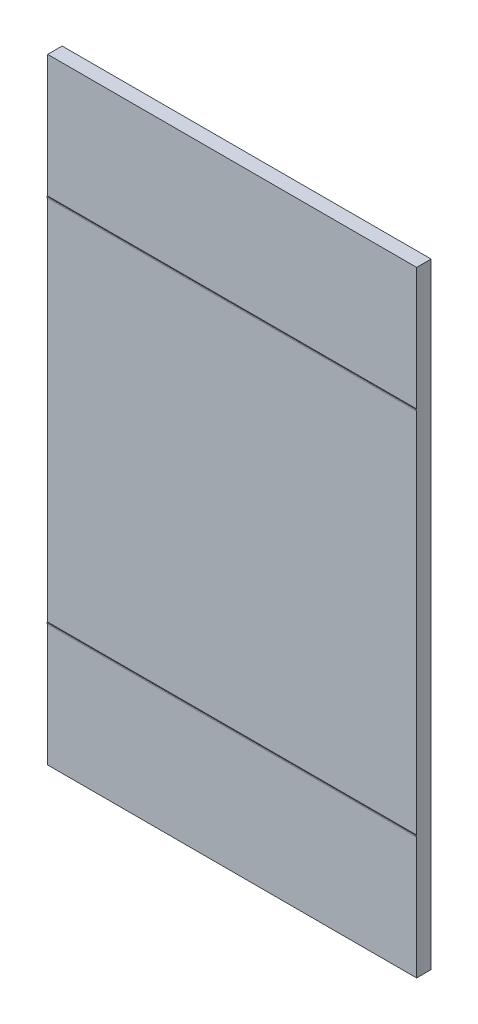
SolidWorks part; units mm, degrees
ref_plane "Front Plane" through (0, 0, 0) normal (1, 0, 0) x (0, 1, 0)
ref_plane "Top Plane" through (0, 0, 0) normal (0, 0, 1) x (0, 1, 0)
ref_plane "Right Plane" through (0, 0, 0) normal (0, 1, 0) x (-1, 0, 0)
sketch "Sketch1" plane through (0, 0, 0) normal (0, 0, 1) x (0, 1, 0)
  line L1 (-637.54, -382.27) -> (637.54, -382.27)
  line L2 (-637.54, -382.27) -> (-637.54, 382.27)
  line L3 (-637.54, 382.27) -> (637.54, 382.27)
  line L4 (637.54, -382.27) -> (637.54, 382.27)
  line L5 (-637.54, -382.27) -> (637.54, 382.27) construction
  line L6 (-637.54, 382.27) -> (637.54, -382.27) construction
  point P0 (0, 0)
  dimension "D1" = 1275.08
  dimension "D2" = 764.54
extrude "Boss-Extrude1" add sketch "Sketch1" along normal blind 29.972
sketch "Sketch2" plane through (0, 0, 0) normal (1, 0, 0) x (0, 1, 0)
  line L0 (-637.54, 29.972) -> (637.54, 29.972) construction
  line L1 (-383.54, 29.972) -> (-381, 29.972)
  line L2 (-383.54, 29.972) -> (-383.54, 31.5595)
  line L3 (-383.54, 31.5595) -> (-381, 31.5595)
  line L4 (-381, 29.972) -> (-381, 31.5595)
  line L5 (-637.54, 29.972) -> (-637.54, 0) construction
  line L6 (0, -16.4846) -> (0, 16.4846) construction
  line L7 (381, 29.972) -> (381, 31.5595)
  line L8 (383.54, 31.5595) -> (381, 31.5595)
  line L9 (383.54, 29.972) -> (383.54, 31.5595)
  line L10 (383.54, 29.972) -> (381, 29.972)
  dimension "D1" = 1.5875
  dimension "D2" = 254
  dimension "D3" = 2.54
extrude "Boss-Extrude2" add sketch "Sketch2" along normal through all and the other way through all
